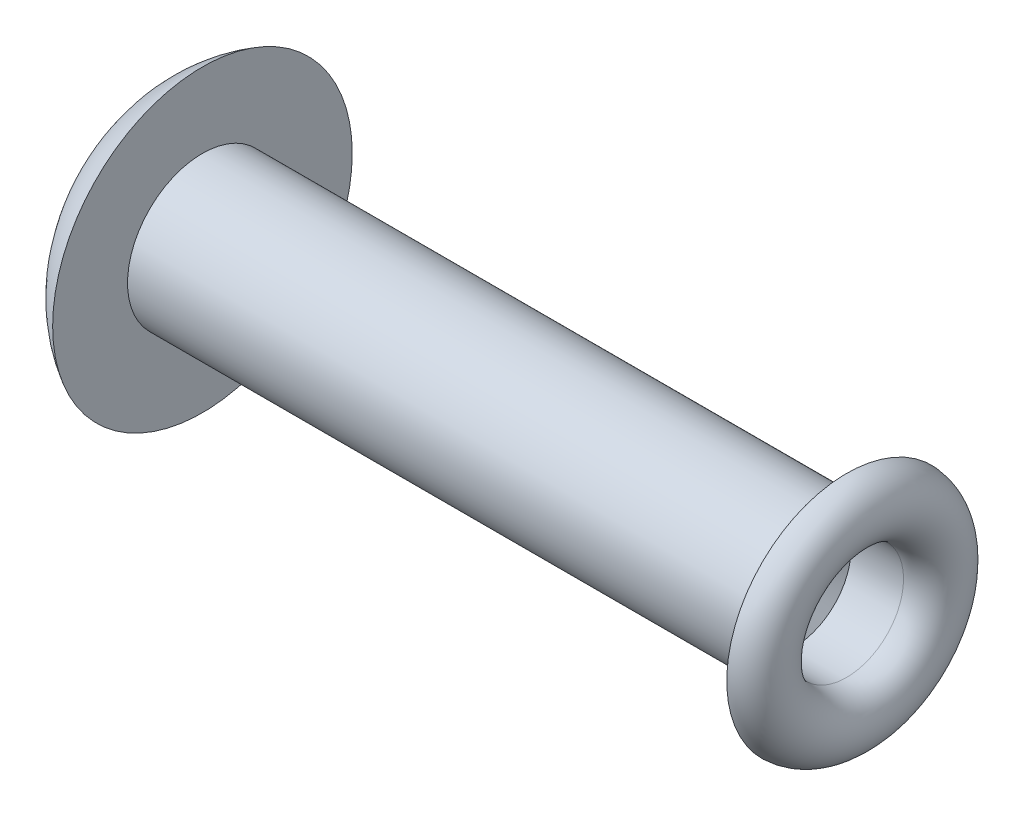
SolidWorks part; units mm, degrees
ref_plane "Plane1" through (0, 0, 0) normal (0, 0, 1) x (1, 0, 0)
ref_plane "Plane2" through (0, 0, 0) normal (0, 1, 0) x (1, 0, 0)
ref_plane "Plane3" through (0, 0, 0) normal (1, 0, 0) x (0, 0, -1)
other "Configuration Table"
sketch "Sketch1" plane through (0, 0, 0) normal (0, 0, 1) x (1, 0, 0)
  line L0 (40.3769, 0) -> (-37, 0) construction
  line L1 (0, 8) -> (0, 6.7941)
  line L2 (-0.1025, 5) -> (-43, 5)
  line L3 (-43, 5) -> (-43, 10)
  line L4 (-5.7833, 0) -> (-47.4, 0)
  line L5 (-47.4, 0) -> (-47.4, 2.5)
  line L6 (0, 3.8) -> (-3.5, 3.8)
  line L7 (-3.5, 3.8) -> (-5.7833, 0)
  line L8 (-3.5, -3.8) -> (-5.7833, 0) construction
  line L9 (-0.1025, 5.9) -> (2, 5.9) construction
  line L10 (7, 0) -> (7, 21.0413) construction
  arc A0 (-43, 10) -> (-47.4, 2.5) centre (-38.808, 2.5) ccw
  arc A1 (0, 3.8) -> (0, 8) centre (-0.1025, 5.9) ccw
  arc A2 (-0.1025, 5) -> (0, 6.7941) centre (-0.1025, 5.9) ccw
  dimension "D1" = 118
  dimension "Diameter" = 10
  dimension "GripLength" = 43
  dimension "HeadHt" = 4.4
  dimension "HeadDia" = 20
  dimension "HeadFlat" = 2.5
  dimension "HoleDepth" = 10.5
  dimension "HoleDia" = 7.6
  dimension "HeadKA" = 2
  dimension "HeadDiaA" = 16
  dimension "Length" = 50
revolve "Base-Revolve" add sketch "Sketch1" angle 360 about L0
